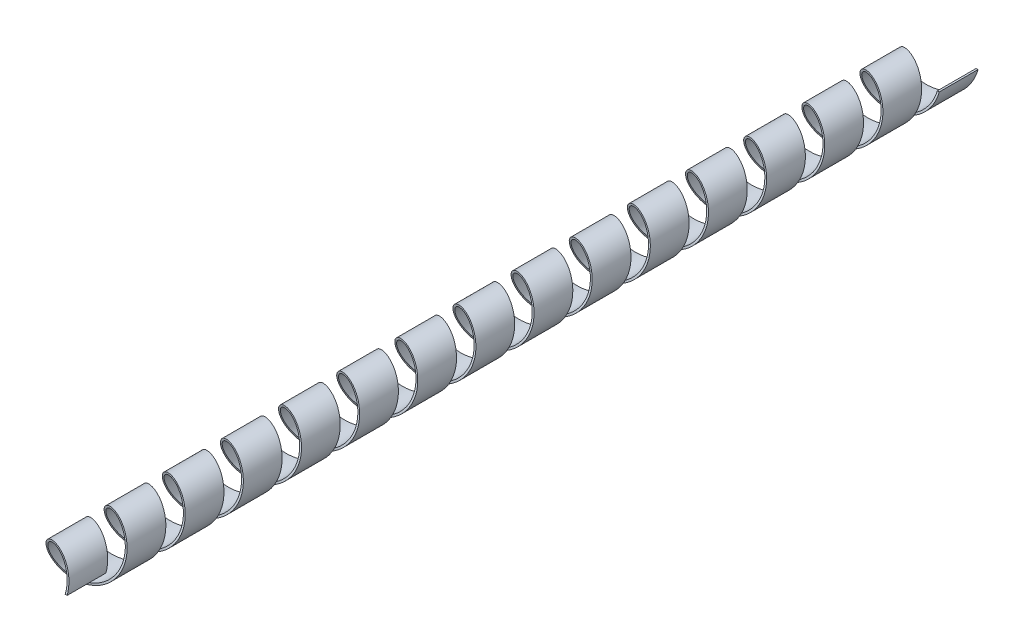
SolidWorks part; units mm, degrees
ref_plane "Ebene vorne" through (0, 0, 0) normal (0, 0, 1) x (1, 0, 0)
ref_plane "Ebene oben" through (0, 0, 0) normal (0, 1, 0) x (1, 0, 0)
ref_plane "Ebene rechts" through (0, 0, 0) normal (1, 0, 0) x (0, 0, -1)
sketch "Skizze1" plane through (0, 0, 0) normal (0, 0, 1) x (1, 0, 0)
  circle A0 centre (0, 0) radius 25
  dimension "D1" = 50
curve "Spirale/Helix1"
ref_plane "Ebene1" through (0, 0, -40) normal (0, 0, 1) x (1, 0, 0)
sketch "Skizze3" plane through (0, 0, -40) normal (0, 0, 1) x (1, 0, 0)
  circle A0 centre (0, 0) radius 25 construction
  circle A1 centre (0, 0) radius 25
curve "Spirale/Helix2"
sketch3d "3D-Skizze1"
  spline S1 degree 3 number of poles 346 (25, 0, 0) -> (25, 0, 900)
  spline S2 degree 3 number of poles 346 (25, 0, 0) -> (25, 0, 900)
  dimension "D1" = 0
sketch3d "3D-Skizze2"
  spline S1 degree 3 number of poles 346 (25, 0, -40) -> (25, 0, 860)
  spline S2 degree 3 number of poles 346 (25, 0, -40) -> (25, 0, 860)
  dimension "D1" = 0
sheet metal parameters "Blech1" thickness 2 parameters "D1"=2, "Dicke"=2
lofted bend "Ausgeformte Biegungen1" parameters "D1"=0, "D12"=2
other "Freiform-Biegung1" parameters "D1"=1000, "D4"=57.296, "D5"=1
flat pattern "Abwicklung1"
sketch "Biegung-Linien1" plane through (25, 0, 0) normal (1, 0, 0) x (0, 0, -1)
  line L0 (40, 0) -> (0, 0) construction
  line L1 (-827.7817, -2271.5671) -> (-867.7817, -2271.5671) construction
other "Abwickeln-<Freiform-Biegung1>1"
equation "\"Radius\"=0"
equation "\"Stückzahl\"= 1"
